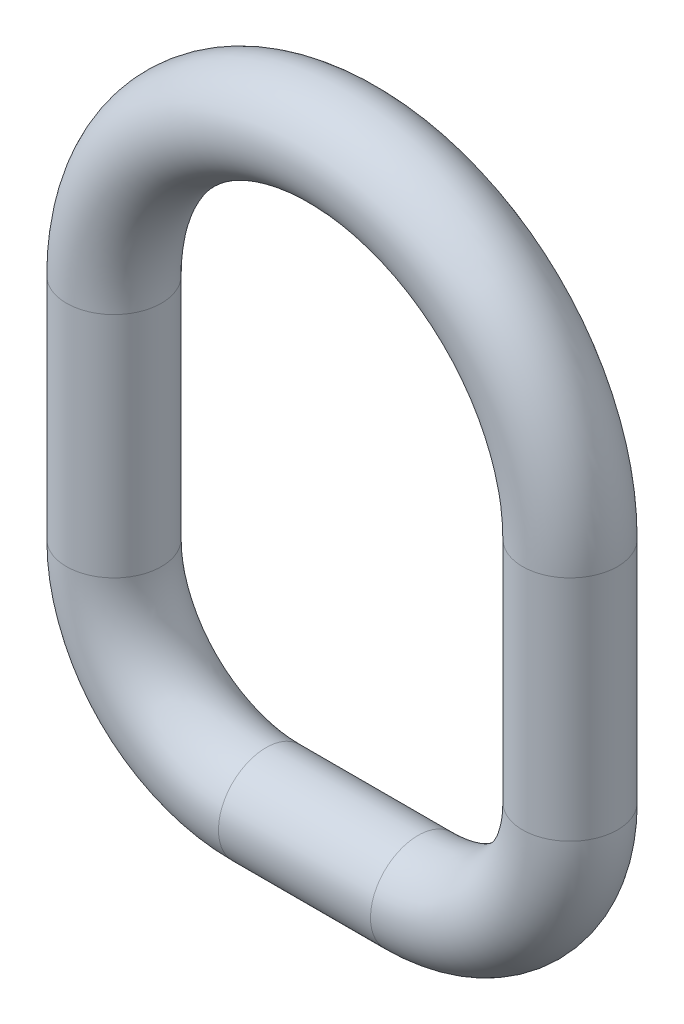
SolidWorks part; units mm, degrees
ref_plane "Front Plane" through (0, 0, 0) normal (0, 0, 1) x (1, 0, 0)
ref_plane "Top Plane" through (0, 0, 0) normal (0, 1, 0) x (1, 0, 0)
ref_plane "Right Plane" through (0, 0, 0) normal (1, 0, 0) x (0, 0, -1)
sketch "Sketch1" plane through (0, 0, 0) normal (0, 0, 1) x (1, 0, 0)
  line L0 (0, 0) -> (6.35, 0)
  line L1 (19.05, 12.7) -> (19.05, 31.75)
  line L2 (-19.05, 31.75) -> (-19.05, 12.7)
  line L3 (0, 0) -> (-6.35, 0)
  arc A0 (6.35, 0) -> (19.05, 12.7) centre (6.35, 12.7) ccw
  arc A1 (-19.05, 31.75) -> (19.05, 31.75) centre (0, 31.75) cw
  arc A2 (-6.35, 0) -> (-19.05, 12.7) centre (-6.35, 12.7) cw
  dimension "D3" = 12.7
  dimension "D1" = 6.35
  dimension "D2" = 19.05
  dimension "D5" = 6.35
sketch "Sketch2" plane through (0, 0, 0) normal (1, 0, 0) x (0, 0, -1)
  circle A0 centre (0, 0) radius 3.9688
  dimension "D1" = 7.9375
sweep "main" add profiles "Sketch2" path "Sketch1"
